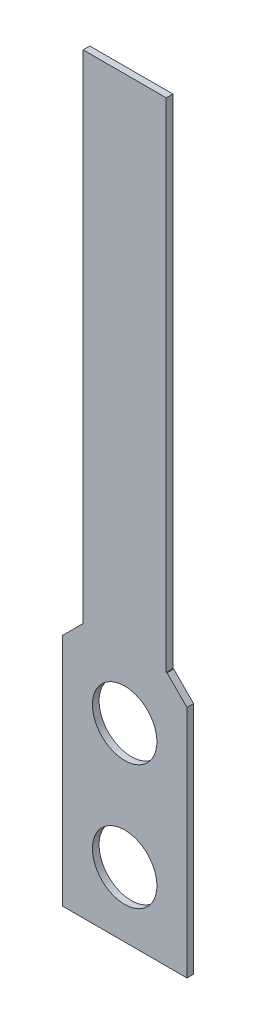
SolidWorks part; units mm, degrees
ref_plane "Front Plane" through (0, 0, 0) normal (0, 0, 1) x (1, 0, 0)
ref_plane "Top Plane" through (0, 0, 0) normal (0, 1, 0) x (1, 0, 0)
ref_plane "Right Plane" through (0, 0, 0) normal (1, 0, 0) x (0, 0, -1)
sketch "Sketch1" plane through (0, 0, 0) normal (0, 0, 1) x (1, 0, 0)
  line L0 (0, 0) -> (0, 101.1495) construction
  line L1 (-4.7625, -9.7155) -> (4.7625, -9.7155)
  line L2 (-4.7625, -9.7155) -> (-4.7625, 9.7155)
  line L3 (-4.7625, 9.7155) -> (4.7625, 9.7155) construction
  line L4 (4.7625, -9.7155) -> (4.7625, 9.7155)
  line L5 (-4.7625, -9.7155) -> (4.7625, 9.7155) construction
  line L6 (-4.7625, 9.7155) -> (4.7625, -9.7155) construction
  line L7 (-4.7625, 9.7155) -> (-3.175, 9.7155)
  line L8 (-3.175, 60.2615) -> (3.175, 60.2615)
  line L9 (-3.175, 60.2615) -> (-3.175, 9.7155)
  line L10 (-3.175, 9.7155) -> (3.175, 9.7155) construction
  line L11 (3.175, 60.2615) -> (3.175, 9.7155)
  line L12 (-3.175, 60.2615) -> (3.175, 9.7155) construction
  line L13 (-3.175, 9.7155) -> (3.175, 60.2615) construction
  line L14 (3.175, 9.7155) -> (4.7625, 9.7155)
  point P0 (0, 0)
  point P8 (0, 34.9885)
  dimension "D1" = 6.35
  dimension "D2" = 9.525
  dimension "D3" = 19.431
  dimension "D4" = 50.546
extrude "Boss-Extrude1" add sketch "Sketch1" along normal blind 0.508
sketch "Sketch2" plane through (0, 0, 0.508) normal (0, 0, 1) x (1, 0, 0)
  line L1 (-1.261, -4.7625) -> (1.261, -4.7625) construction
  line L2 (-1.261, -4.7625) -> (-1.261, 4.7625) construction
  line L3 (-1.261, 4.7625) -> (1.261, 4.7625) construction
  line L4 (1.261, -4.7625) -> (1.261, 4.7625) construction
  line L5 (-1.261, -4.7625) -> (1.261, 4.7625) construction
  line L6 (-1.261, 4.7625) -> (1.261, -4.7625) construction
  circle A0 centre (0, 4.7625) radius 2.4638
  circle A1 centre (0, -4.7625) radius 2.4638
  point P0 (0, 0)
  dimension "D2" = 4.9276
  dimension "D3" = 9.525
extrude "Cut-Extrude1" cut sketch "Sketch2" against normal through all
chamfer "Chamfer1" distance 1.524 angle 45 2 edges at (-4.7625, 9.7155, 0.254) (4.7625, 9.7155, 0.254)
sketch "Sketch3" plane through (0, 0, 0.508) normal (0, 0, 1) x (1, 0, 0)
  line L0 (3.175, 9.7155) -> (3.175, 60.2615) construction
  line L1 (-3.175, 60.2615) -> (3.175, 60.2615)
  line L2 (-3.175, 60.2615) -> (-3.175, 47.7434)
  line L3 (-3.175, 47.7434) -> (3.175, 47.7434)
  line L4 (3.175, 60.2615) -> (3.175, 47.7434)
extrude "Cut-Extrude2" cut sketch "Sketch3" against normal through all
